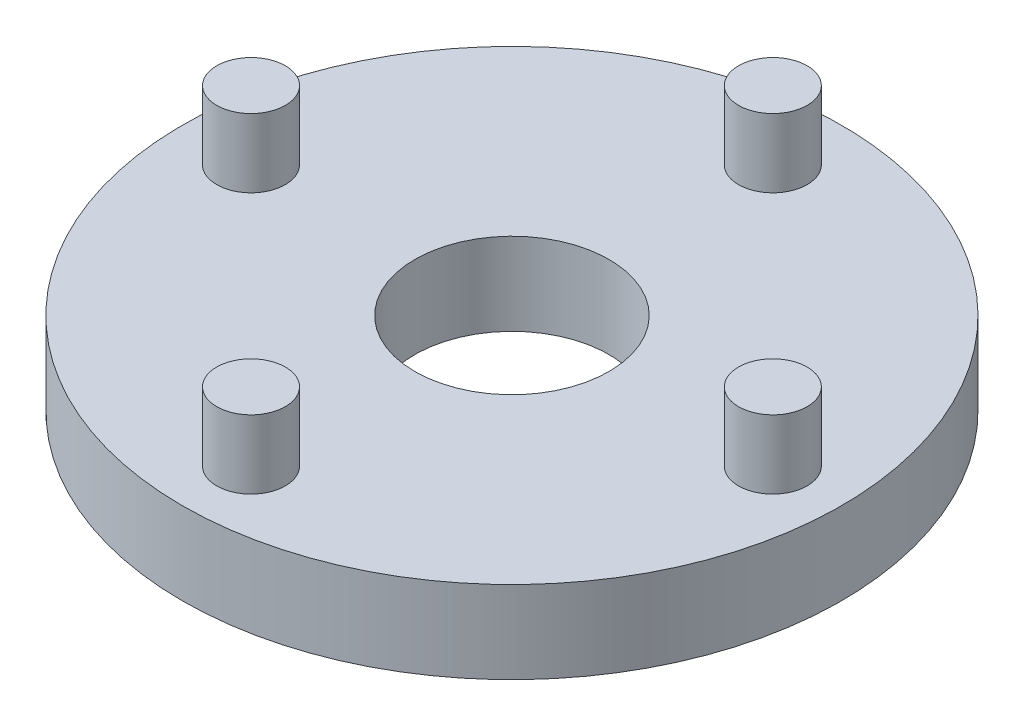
SolidWorks part; units mm, degrees
ref_plane "Front Plane" through (0, 0, 0) normal (0, 0, 1) x (1, 0, 0)
ref_plane "Top Plane" through (0, 0, 0) normal (0, 1, 0) x (1, 0, 0)
ref_plane "Right Plane" through (0, 0, 0) normal (1, 0, 0) x (0, 0, -1)
sketch "Sketch1" plane through (0, 0, 0) normal (0, 1, 0) x (1, 0, 0)
  circle A0 centre (0, 0) radius 24
  dimension "D1" = 48
extrude "Boss-Extrude1" add sketch "Sketch1" along normal blind 6
sketch "Sketch3" plane through (0, 6, 0) normal (0, 1, 0) x (1, 0, 0)
  circle A1 centre (0, 0) radius 7.0711
extrude "Cut-Extrude2" cut sketch "Sketch3" against normal blind 6
sketch "Sketch12" plane through (0, 6, 0) normal (0, 1, 0) x (1, 0, 0)
  circle A0 centre (-19, 0) radius 2.5
  circle A1 centre (0, 19) radius 2.5
  circle A2 centre (19, 0) radius 2.5
  circle A3 centre (0, -19) radius 2.5
  point P12 (0, 0)
  dimension "D1" = 5
  dimension "D2" = 19
  dimension "D3" = 4
extrude "Boss-Extrude2" add sketch "Sketch12" along normal blind 5
sketch "Sketch13" plane through (0, 0, 0) normal (0, -1, 0) x (1, 0, 0)
  circle A0 centre (0, 0) radius 10.5
  circle A1 centre (0, 0) radius 21
  dimension "D1" = 42
  dimension "D2" = 21
extrude "Cut-Extrude3" cut sketch "Sketch13" against normal blind 4
